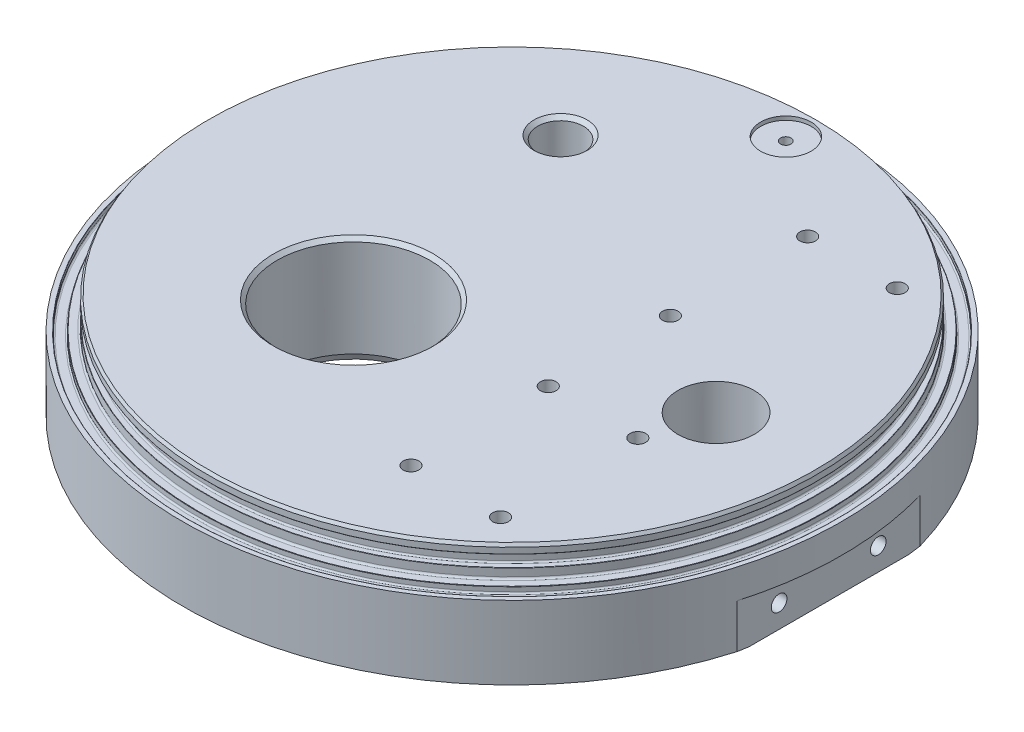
SolidWorks part; units mm, degrees
ref_plane "Front Plane" through (0, 0, 0) normal (0, 0, 1) x (1, 0, 0)
ref_plane "Top Plane" through (0, 0, 0) normal (0, 1, 0) x (1, 0, 0)
ref_plane "Right Plane" through (0, 0, 0) normal (1, 0, 0) x (0, 0, -1)
sketch "Sketch1" plane through (0, 0, 0) normal (0, 0, 1) x (1, 0, 0)
  line L0 (-127, 43.18) -> (-127, 40.767)
  line L1 (0, 0) -> (-135.89, 0)
  line L2 (0, 0) -> (0, 44.45)
  line L3 (0, 44.45) -> (-126.2668, 44.45)
  line L4 (-137.16, 0.7332) -> (-137.16, 28.5247)
  line L5 (-127.7938, 31.75) -> (-130.683, 31.75)
  line L6 (-130.81, 31.623) -> (-130.81, 29.8196)
  line L7 (-131.445, 29.1846) -> (-134.493, 29.1846)
  line L8 (-135.128, 29.8196) -> (-135.128, 31.115)
  line L9 (-126.873, 40.64) -> (-124.9172, 40.64)
  line L10 (-124.2822, 40.005) -> (-124.2822, 36.449)
  line L11 (-124.9172, 35.814) -> (-126.873, 35.814)
  line L12 (-127, 35.687) -> (-127, 32.5437)
  line L13 (-135.255, 31.242) -> (-137.16, 31.242)
  line L14 (-126.2668, 44.45) -> (-127, 43.18)
  line L15 (-135.89, 0) -> (-137.16, 0.7332)
  line L16 (-137.16, 31.242) -> (-137.16, 28.5247)
  line L17 (-127.127, 46.9424) -> (-127.127, 33.1155) construction
  arc A0 (-124.9172, 40.64) -> (-124.2822, 40.005) centre (-124.9172, 40.005) cw
  arc A1 (-124.2822, 36.449) -> (-124.9172, 35.814) centre (-124.9172, 36.449) cw
  arc A2 (-130.81, 29.8196) -> (-131.445, 29.1846) centre (-131.445, 29.8196) cw
  arc A3 (-134.493, 29.1846) -> (-135.128, 29.8196) centre (-134.493, 29.8196) cw
  arc A4 (-135.128, 31.115) -> (-135.255, 31.242) centre (-135.255, 31.115) ccw
  arc A5 (-127, 32.5437) -> (-127.7938, 31.75) centre (-127.7938, 32.5437) cw
  arc A6 (-130.81, 31.623) -> (-130.683, 31.75) centre (-130.683, 31.623) cw
  arc A7 (-126.873, 35.814) -> (-127, 35.687) centre (-126.873, 35.687) ccw
  arc A8 (-126.873, 40.64) -> (-127, 40.767) centre (-126.873, 40.767) cw
  point P3 (-137.16, 0)
  point P5 (-127, 44.45)
  point P17 (-124.2822, 40.64)
  point P20 (-124.2822, 35.814)
  point P23 (-130.81, 29.1846)
  point P26 (-135.128, 29.1846)
  point P29 (-135.128, 31.75)
  point P32 (-127, 31.75)
  point P37 (-127, 35.814)
  point P40 (-127, 40.64)
  dimension "D9" = 0.635
  dimension "D10" = 0.127
  dimension "D16" = 0.7937
  dimension "D1" = 137.16
  dimension "D2" = 12.7
  dimension "D3" = 127
  dimension "D4" = 2.8448
  dimension "D5" = 4.826
  dimension "D6" = 2.5654
  dimension "D7" = 4.318
  dimension "D8" = 130.81
  dimension "D11" = 1.27
  dimension "D12" = 30
  dimension "D13" = 1.27
  dimension "D14" = 30
  dimension "D15" = 44.45
  dimension "D17" = 3.81
  dimension "D18" = 127.127
  dimension "D19" = 0.508
revolve "Revolve1" add sketch "Sketch1" angle 360 about L2
sketch "Sketch2" plane through (0, 0, 0) normal (0, -1, 0) x (1, 0, 0)
  line L0 (-31.0918, 34.9126) -> (-31.0918, 162.5876) construction
  line L1 (-31.0918, 34.9126) -> (1.8377, 108.8735) construction
  circle A0 centre (-31.0918, 34.9126) radius 51.4985
  dimension "D1" = 102.997
  dimension "D2" = 24
hole_wizard "M6x1.0 Tapped Hole1" positions "Sketch3" profile "Sketch4" tap size "M6x1.0" standard "ANSI Metric"
sketch "Sketch3" plane through (0, 0, 0) normal (0, -1, 0) x (1, 0, 0)
  line L0 (-31.0918, 34.9126) -> (1.8377, 108.8735) construction
  circle A0 centre (-31.0918, 34.9126) radius 51.4985 construction
  point P0 (-10.1455, 81.9588)
sketch "Sketch4" plane through (-10.1455, 0, 81.9588) normal (1, 0, 0) x (0, 0, -1)
  line L0 (0, 0) -> (0, 16.4882)
  line L1 (0, 16.4882) -> (2.5, 14.986)
  line L2 (2.5, 14.986) -> (2.5, 0)
  line L5 (2.5, 0) -> (0, 0)
  line L10 (0, 16.4882) -> (-2.5, 14.986) construction
  line L11 (0, -6.35) -> (0, 107.95) construction
  dimension "Tap Drill Dia." = 5
  dimension "Tap Drill Depth" = 14.986
  dimension "Drill Angle" = 118
sketch "Sketch5" plane through (0, 0, 0) normal (0, -1, 0) x (1, 0, 0)
  circle A0 centre (-31.0918, 34.9126) radius 31.75
  dimension "D1" = 63.5
extrude "Cut-Extrude1" cut sketch "Sketch5" against normal through all
pattern_circular "CirPattern2" count 6 every 48 about axis through (-31.0918, 0, 34.9126) along (0, 1, 0) of "M6x1.0 Tapped Hole1"
chamfer "Chamfer1" distance 2.54 angle 18 1 edges at (0.6582, 0, 34.9126)
hole_wizard "3/4 (0.75) Diameter Hole1" positions "Sketch6" profile "Sketch7" hole size "3/4" standard "ANSI Inch"
sketch "Sketch6" plane through (0, 0, 0) normal (0, -1, 0) x (-1, 0, 0)
  point P0 (47.3986, 67.5788)
sketch "Sketch7" plane through (-47.3986, 0, -67.5788) normal (1, 0, 0) x (0, 0, -1)
  line L0 (0, 0) -> (0, 44.45)
  line L1 (0, 44.45) -> (9.525, 44.45)
  line L2 (9.525, 44.45) -> (9.525, 0)
  line L5 (9.525, 0) -> (0, 0)
  line L11 (0, -6.35) -> (0, 107.95) construction
  dimension "Thru Hole Dia." = 19.05
  dimension "Thru Hole Depth" = 44.45
chamfer "Chamfer2" distance 2.032 angle 15 1 edges at (-47.3986, 0, -77.1038)
chamfer "Chamfer3" distance 1.524 angle 45 1 edges at (-47.3986, 44.45, -77.1038)
chamfer "Chamfer4" distance 1.524 angle 45 1 edges at (0.6582, 44.45, 34.9126)
sketch "Sketch8" plane through (0, 0, 0) normal (0, -1, 0) x (-1, 0, 0)
  line L0 (47.3986, 67.5788) -> (16.6155, 36.7957) construction
hole_wizard "M4x0.7 Tapped Hole2" positions "Sketch13" profile "Sketch14" tap size "M4x0.7" standard "ANSI Metric"
sketch "Sketch13" plane through (0, 0, 0) normal (0, -1, 0) x (1, 0, 0)
  line L0 (-47.3986, -67.5788) -> (-16.6155, -36.7957) construction
  point P0 (-35.9578, -56.1379)
  dimension "D1" = 16.1798
sketch "Sketch14" plane through (-35.9578, 0, -56.1379) normal (1, 0, 0) x (0, 0, -1)
  line L0 (0, 0) -> (0, 9.9576)
  line L1 (0, 9.9576) -> (1.65, 8.9662)
  line L2 (1.65, 8.9662) -> (1.65, 0)
  line L5 (1.65, 0) -> (0, 0)
  line L10 (0, 9.9576) -> (-1.65, 8.9662) construction
  line L11 (0, -6.35) -> (0, 107.95) construction
  dimension "Tap Drill Dia." = 3.3
  dimension "Tap Drill Depth" = 8.9662
  dimension "Drill Angle" = 118
pattern_circular "CirPattern3" count 4 over 360 about axis through (-47.3986, 0, -67.5788) along (0, 1, 0) of "M4x0.7 Tapped Hole2"
sketch "Sketch15" plane through (0, 0, 0) normal (0, -1, 0) x (1, 0, 0)
  circle A0 centre (84.8952, 0) radius 15.875
  dimension "D1" = 31.75
extrude "Cut-Extrude2" cut sketch "Sketch15" against normal through all
chamfer "Chamfer5" distance 0.508 angle 20 1 edges at (100.7702, 0, 0)
sketch "Sketch16" plane through (0, 0, 0) normal (0, -1, 0) x (1, 0, 0)
  circle A0 centre (84.8952, 0) radius 33.274
  dimension "D1" = 66.548
extrude "Cut-Extrude3" cut sketch "Sketch16" against normal blind 0.0254
sketch "Sketch17" plane through (0, 0.0254, 0) normal (0, -1, 0) x (1, 0, 0)
  line L0 (84.8952, 0) -> (84.8952, 44.3986) construction
  line L1 (84.8952, 0) -> (122.5491, 37.654) construction
hole_wizard "#8-32 Tapped Hole1" positions "Sketch18" profile "Sketch19" tap size "#8-32" standard "ANSI Inch"
sketch "Sketch18" plane through (0, 0.0254, 0) normal (0, -1, 0) x (1, 0, 0)
  line L0 (84.8952, 0) -> (122.5491, 37.654) construction
  line L1 (84.8952, 0) -> (84.8952, 44.3986) construction
  point P0 (104.631, 19.7358)
  dimension "D1" = 19.7358
sketch "Sketch19" plane through (104.631, 0.0254, 19.7358) normal (1, 0, 0) x (0, 0, -1)
  line L0 (0, 0) -> (0, 11.7566)
  line L1 (0, 11.7566) -> (1.7272, 10.7188)
  line L2 (1.7272, 10.7188) -> (1.7272, 0)
  line L5 (1.7272, 0) -> (0, 0)
  line L10 (0, 11.7566) -> (-1.7272, 10.7188) construction
  line L11 (0, -6.35) -> (0, 107.95) construction
  dimension "Tap Drill Dia." = 3.4544
  dimension "Tap Drill Depth" = 10.7188
  dimension "Drill Angle" = 118
pattern_circular "CirPattern4" count 4 every 90 about axis through (84.8952, 0, 0) along (0, 1, 0) of "#8-32 Tapped Hole1"
hole_wizard "5/16-18 Tapped Hole1" positions "Sketch20" profile "Sketch21" tap size "5/16-18" standard "ANSI Inch"
sketch "Sketch20" plane through (0, 44.45, 0) normal (0, 1, 0) x (1, 0, 0)
  point P0 (77.7994, 82.4936)
  point P3 (40.5222, 82.4936)
  point P6 (77.7994, -82.6064)
  point P9 (40.5222, -82.6064)
  point P12 (77.7994, -25.4564)
  point P15 (40.5222, -25.4564)
sketch "Sketch21" plane through (77.7994, 44.45, -82.4936) normal (1, 0, 0) x (0, 0, 1)
  line L0 (0, 0) -> (0, 9.2509)
  line L1 (0, 9.2509) -> (3.2639, 7.2898)
  line L2 (3.2639, 7.2898) -> (3.2639, 0)
  line L5 (3.2639, 0) -> (0, 0)
  line L10 (0, 9.2509) -> (-3.2639, 7.2898) construction
  line L11 (0, -6.35) -> (0, 107.95) construction
  dimension "Tap Drill Dia." = 6.5278
  dimension "Tap Drill Depth" = 7.2898
  dimension "Drill Angle" = 118
hole_wizard "5/16-18 Tapped Hole2" positions "Sketch22" profile "Sketch23" tap size "5/16-18" standard "ANSI Inch"
sketch "Sketch22" plane through (0, 44.45, 0) normal (0, 1, 0) x (1, 0, 0)
  point P0 (40.5222, 25.3436)
sketch "Sketch23" plane through (40.5222, 44.45, -25.3436) normal (1, 0, 0) x (0, 0, 1)
  line L0 (0, 0) -> (0, 9.2509)
  line L1 (0, 9.2509) -> (3.2639, 7.2898)
  line L2 (3.2639, 7.2898) -> (3.2639, 0)
  line L5 (3.2639, 0) -> (0, 0)
  line L10 (0, 9.2509) -> (-3.2639, 7.2898) construction
  line L11 (0, -6.35) -> (0, 107.95) construction
  dimension "Tap Drill Dia." = 6.5278
  dimension "Tap Drill Depth" = 7.2898
  dimension "Drill Angle" = 118
sketch "Sketch24" plane through (0, 44.45, 0) normal (0, 1, 0) x (1, 0, 0)
  circle A0 centre (0, 113.9514) radius 10.5156
  dimension "D1" = 21.0312
extrude "Cut-Extrude4" cut sketch "Sketch24" against normal blind 1.5748
hole_wizard "#17 (0.173) Diameter Hole1" positions "Sketch25" profile "Sketch26" hole size "#17" standard "ANSI Inch"
sketch "Sketch25" plane through (0, 0, 0) normal (0, -1, 0) x (-1, 0, 0)
  point P0 (0, 113.9037)
sketch "Sketch26" plane through (0, 0, -113.9037) normal (1, 0, 0) x (0, 0, -1)
  line L0 (0, 0) -> (0, 44.45)
  line L1 (0, 44.45) -> (2.1971, 44.45)
  line L2 (2.1971, 44.45) -> (2.1971, 0)
  line L5 (2.1971, 0) -> (0, 0)
  line L11 (0, -6.35) -> (0, 107.95) construction
  dimension "Thru Hole Dia." = 4.3942
  dimension "Thru Hole Depth" = 44.45
sketch "Sketch29" [suppressed] plane through (0, 0, 0) normal (0, -1, 0) x (1, 0, 0)
  line L0 (-175.319, 0) -> (0, 0)
  line L1 (0, 0) -> (0, 175.319)
  arc A0 (-175.319, 0) -> (0, 175.319) centre (0, 0) ccw
extrude "FEA CUT" [suppressed] cut sketch "Sketch29" against normal through all
sketch "Sketch30" plane through (0, 0, 0) normal (0, -1, 0) x (1, 0, 0)
  line L0 (-31.0918, 34.9126) -> (0, 0) construction
  line L1 (0, 0) -> (130.3051, 116.0448)
  line L2 (0, 0) -> (-116.0448, 130.3051)
  arc A0 (-116.0448, 130.3051) -> (130.3051, 116.0448) centre (0, 0) ccw
extrude "FEA CUT2" [suppressed] cut sketch "Sketch30" against normal through all
hole_wizard "SAE#4" positions "Sketch210" profile "Sketch31" legacy
sketch "Sketch210" plane through (-52.9186, 0, -33.9612) normal (0, -1, 0) x (1, 0, 0)
  circle A0 centre (52.9186, -79.9425) radius 2.1971 construction
  point P0 (52.9186, -79.9425)
sketch "Sketch31" plane through (0, 0, -113.9037) normal (1, 0, 0) x (0, 0, -1)
  line L0 (0, 0) -> (0, 13.8938)
  line L1 (0, 13.8938) -> (4.9606, 13.8938)
  line L2 (4.9606, 13.8938) -> (4.9606, 3.0844)
  line L3 (5.6828, 2.3622) -> (6.1849, 0)
  line L4 (6.1849, 0) -> (0, 0)
  line L5 (0, -6.4453) -> (0, 42.3633) construction
  line L6 (-5.5563, 2.9576) -> (-6.1849, 0) construction
  line L7 (4.9606, 3.0844) -> (5.6828, 2.3622)
  line L8 (-249.7937, 0) -> (21.9863, 0) construction
  dimension "Diameter" = 9.9212
  dimension "Depth" = 13.8938
  dimension "C-Sink Angle" = 24
  dimension "C-Sink Diameter" = 12.3698
sketch "Sketch51" plane through (12.0657, 13.8938, -98.0364) normal (0, -1, 0) x (1, 0, 0)
  circle A0 centre (-12.0657, -15.8673) radius 2.1844
  circle A1 centre (-12.0657, -15.8673) radius 6.1849 construction
  dimension "D1" = 4.3688
extrude "Thru hole.172" [suppressed] cut sketch "Sketch51" against normal through all
sketch "Sketch61" plane through (12.0657, 0, -98.0364) normal (0, -1, 0) x (1, 0, 0)
  circle A0 centre (-12.0657, -15.8673) radius 10.5156
  circle A1 centre (-12.0657, -15.8673) radius 6.1849 construction
  dimension "D1" = 21.0312
extrude "Cut-Extrude11" cut sketch "Sketch61" against normal blind 0.254
other "SAE#4-Port-thru<1>" [suppressed]
sketch "Sketch212" plane through (0, 0, 0) normal (0, -1, 0) x (-1, 0, 0)
  circle A0 centre (31.0918, -34.9126) radius 57.531
  dimension "D1" = 115.062
extrude "Cut-Extrude12" cut sketch "Sketch212" against normal blind 0.127 contours A0
sketch "Sketch214" plane through (0, 0, 0) normal (0, -1, 0) x (1, 0, 0)
  line L0 (0, 132.3634) -> (0, -169.1401) construction
  line L1 (-156.5973, 38.1) -> (163.0604, 38.1) construction
  line L2 (-162.6488, -38.1) -> (184.4184, -38.1) construction
  line L3 (131.7621, -38.1) -> (139.5668, -38.1)
  line L4 (-131.7621, 38.1) -> (-139.5668, 38.1)
  line L5 (-131.7621, 38.1) -> (-131.7621, -38.1)
  line L6 (-131.7621, -38.1) -> (-139.5668, -38.1)
  line L7 (-139.5668, 38.1) -> (-139.5668, -38.1)
  line L8 (139.5668, 38.1) -> (139.5668, -38.1)
  line L9 (131.7621, 38.1) -> (139.5668, 38.1)
  line L10 (131.7621, 38.1) -> (131.7621, -38.1)
  circle A1 centre (0, 0) radius 137.16 construction
  dimension "D1" = 38.1
  dimension "D2" = 76.2
extrude "Cut-Extrude14" cut sketch "Sketch214" against normal blind 19.05
hole_wizard "5/16-18 Tapped Hole3" positions "Sketch215" profile "Sketch216" tap size "5/16-18" standard "ANSI Inch"
sketch "Sketch215" plane through (-131.7621, 0, 0) normal (-1, 0, 0) x (0, 0, 1)
  line L0 (-16.5859, 0) -> (86.4111, 0) construction
  line L1 (-33.2391, 0) -> (33.2391, 0) construction
  line L2 (38.1, 19.05) -> (38.1, 0.7332) construction
  line L3 (-38.1, 19.05) -> (-38.1, 0.7332) construction
  point P0 (20.6375, 9.525)
  point P2 (-20.6375, 9.525)
  point P11 (38.1, 9.8916)
  point P14 (-38.1, 9.8916)
  dimension "D1" = 9.525
  dimension "D2" = 9.525
  dimension "D3" = 41.275
  dimension "D4" = 17.4625
  dimension "D5" = 17.4625
sketch "Sketch216" plane through (-131.7621, 9.525, 20.6375) normal (0, 1, 0) x (0, 0, 1)
  line L0 (0, 0) -> (0, 22.0779)
  line L1 (0, 22.0779) -> (3.2639, 20.1168)
  line L2 (3.2639, 20.1168) -> (3.2639, 0)
  line L5 (3.2639, 0) -> (0, 0)
  line L10 (0, 22.0779) -> (-3.2639, 20.1168) construction
  line L11 (0, -6.35) -> (0, 107.95) construction
  dimension "Tap Drill Dia." = 6.5278
  dimension "Tap Drill Depth" = 20.1168
  dimension "Drill Angle" = 118
hole_wizard "5/16-18 Tapped Hole4" positions "Sketch217" profile "Sketch218" tap size "5/16-18" standard "ANSI Inch"
sketch "Sketch217" plane through (131.7621, 0, 0) normal (1, 0, 0) x (0, 0, -1)
  line L0 (-86.4111, 0) -> (16.5859, 0) construction
  line L1 (-33.2391, 0) -> (33.2391, 0) construction
  line L2 (-38.1, 19.05) -> (-38.1, 0.7332) construction
  point P0 (-20.6375, 9.525)
  point P2 (20.6375, 9.525)
  point P11 (-38.1, 9.8916)
  dimension "D1" = 9.525
  dimension "D2" = 9.525
  dimension "D3" = 17.4625
  dimension "D4" = 41.275
sketch "Sketch218" plane through (131.7621, 9.525, 20.6375) normal (0, 1, 0) x (0, 0, -1)
  line L0 (0, 0) -> (0, 22.0779)
  line L1 (0, 22.0779) -> (3.2639, 20.1168)
  line L2 (3.2639, 20.1168) -> (3.2639, 0)
  line L5 (3.2639, 0) -> (0, 0)
  line L10 (0, 22.0779) -> (-3.2639, 20.1168) construction
  line L11 (0, -6.35) -> (0, 107.95) construction
  dimension "Tap Drill Dia." = 6.5278
  dimension "Tap Drill Depth" = 20.1168
  dimension "Drill Angle" = 118
sketch "Sketch219" plane through (0, 0, 0) normal (0, -1, 0) x (1, 0, 0)
  circle A0 centre (-47.3986, -67.5788) radius 22.225
  dimension "D1" = 44.45
extrude "Cut-Extrude15" cut sketch "Sketch219" against normal blind 0.127
